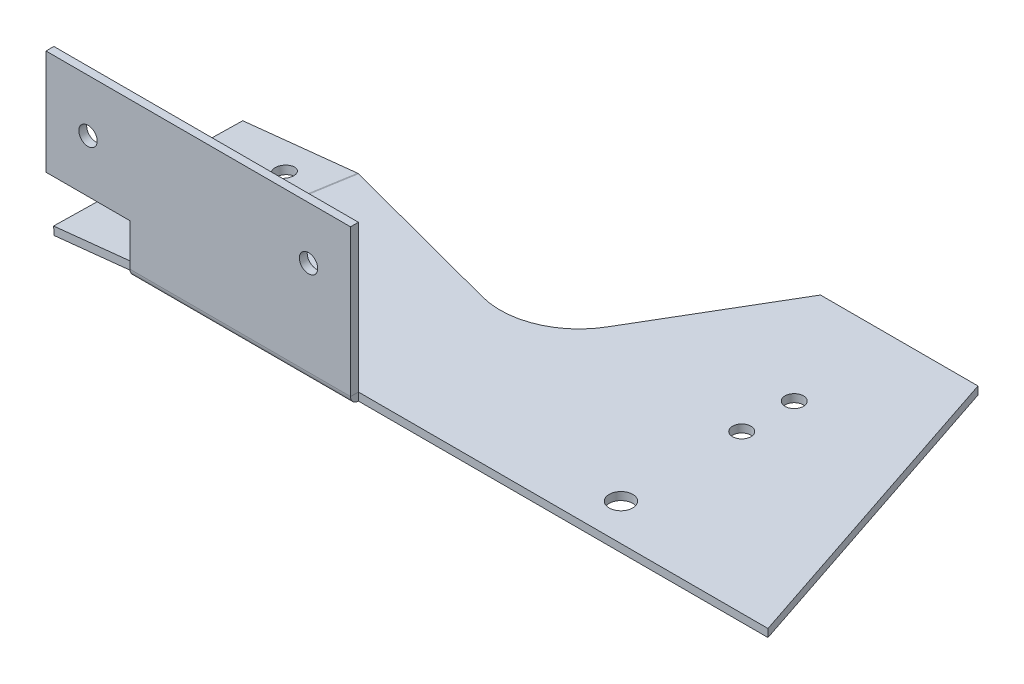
SolidWorks part; units mm, degrees
ref_plane "Front Plane" through (0, 0, 0) normal (0, 0, 1) x (1, 0, 0)
ref_plane "Top Plane" through (0, 0, 0) normal (0, 1, 0) x (1, 0, 0)
ref_plane "Right Plane" through (0, 0, 0) normal (1, 0, 0) x (0, 0, -1)
sketch "Sketch1" plane through (0, 0, 0) normal (0, 1, 0) x (1, 0, 0)
  line L0 (0, 0) -> (58, 0)
  line L1 (58, 0) -> (58, 28)
  line L2 (58, 28) -> (136, 28)
  line L3 (136, 28) -> (116, 88)
  line L4 (116, 88) -> (86, 88)
  line L5 (86, 88) -> (70.927, 62.3913)
  line L6 (54.167, 55.498) -> (22, 64)
  line L7 (22, 64) -> (0, 64)
  line L8 (0, 64) -> (0, 28)
  line L9 (0, 28) -> (16, 28)
  line L10 (16, 28) -> (16, 20)
  line L11 (16, 20) -> (0, 20)
  line L12 (0, 20) -> (0, 0)
  line L13 (0, 10) -> (58, 10) construction
  line L14 (101, 28) -> (101, 71.9333) construction
  arc A0 (54.167, 55.498) -> (70.927, 62.3913) centre (58, 70) ccw
  circle A1 centre (8, 10) radius 1.75
  circle A2 centre (50, 10) radius 1.75
  circle A3 centre (101, 35) radius 2.25
  circle A4 centre (101, 58) radius 1.75
  circle A5 centre (101, 68) radius 1.75
  circle A6 centre (14, 58) radius 1.75
  circle A7 centre (11, 38) radius 1.75
  dimension "D11" = 15
  dimension "D15" = 4.5
  dimension "D16" = 3.5
  dimension "D18" = 8
  dimension "D19" = 8
  dimension "D20" = 11
  dimension "D21" = 14
  dimension "D23" = 20
  dimension "D25" = 7
  dimension "D26" = 10
  dimension "D27" = 30
  dimension "D1" = 58
  dimension "D2" = 60
  dimension "D3" = 20
  dimension "D4" = 8
  dimension "D5" = 36
  dimension "D6" = 28
  dimension "D7" = 136
  dimension "D8" = 20
  dimension "D9" = 30
  dimension "D10" = 22
  dimension "D12" = 36
  dimension "D13" = 18
  dimension "D14" = 16
  dimension "D17" = 10
  dimension "D22" = 10
  dimension "D24" = 35
sheet metal parameters "Sheet-Metal1" thickness 1.5 parameters "D1"=1
base flange "Base-Flange1" sketch "Sketch1" thickness 1.5 reverse thickness direction yes parameters "D1"=1
sketch "Sketch3" plane through (0, 1.5, 0) normal (0, 1, 0) x (1, 0, 0)
  line L0 (16, 28) -> (58, 28)
sketched bend "Sketched Bend1" parameters "D1"=0.001
bend "SketchBend1" bend radius 0.001 bend angle 90 parameters "D5"=1
sketch "Sketch4" plane through (0, 1.5, 0) normal (0, 1, 0) x (1, 0, 0)
  line L0 (22, 64) -> (16, 28)
sketched bend "Sketched Bend2" parameters "D1"=0.1
bend "SketchBend2" bend radius 0.1 bend angle 6 parameters "D5"=2
flat pattern "Flat-Pattern1"
sketch "Bend-Lines1" plane through (0, 0, 0) normal (0, 1, 0) x (-1, 0, 0)
bend of the flat pattern "Flatten-<SketchBend1>1"
bend of the flat pattern "Flatten-<SketchBend2>1"
